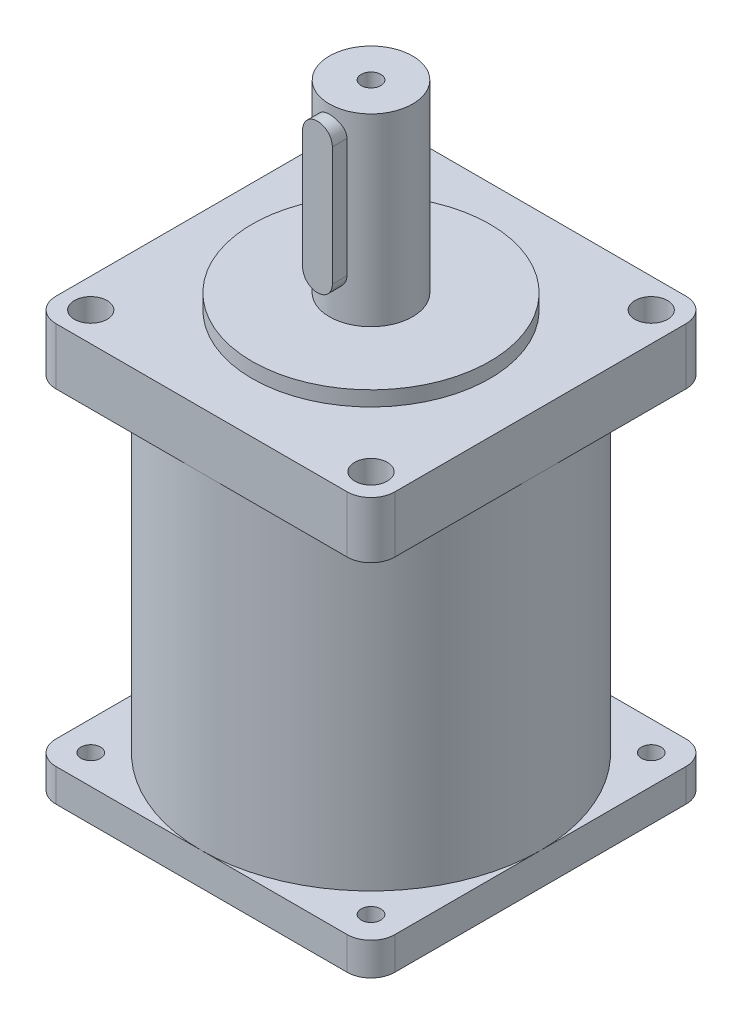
SolidWorks part; units mm, degrees
ref_plane "前视" through (0, 0, 0) normal (0, 0, 1) x (1, 0, 0)
ref_plane "上视" through (0, 0, 0) normal (0, 1, 0) x (1, 0, 0)
ref_plane "右视" through (0, 0, 0) normal (1, 0, 0) x (0, 0, -1)
sketch "草图1" plane through (0, 0, 0) normal (0, 1, 0) x (1, 0, 0)
  line L1 (-28.5, 28.5) -> (28.5, 28.5)
  line L2 (-28.5, 28.5) -> (-28.5, -28.5)
  line L3 (-28.5, -28.5) -> (28.5, -28.5)
  line L4 (28.5, 28.5) -> (28.5, -28.5)
  line L5 (-28.5, 28.5) -> (28.5, -28.5) construction
  line L6 (-28.5, -28.5) -> (28.5, 28.5) construction
  point P0 (0, 0)
extrude "凸台-拉伸1" add sketch "草图1" along normal blind 9.5
ref_plane "基准面1" through (0, 9.5, 0) normal (0, 1, 0) x (1, 0, 0)
sketch "草图2" plane through (0, 9.5, 0) normal (0, 1, 0) x (1, 0, 0)
  circle A0 centre (0, 0) radius 20
  dimension "D1" = 40
extrude "凸台-拉伸2" add sketch "草图2" along normal blind 2.5
sketch "草图3" plane through (0, 9.5, 0) normal (0, 1, 0) x (1, 0, 0)
  circle A0 centre (0, 0) radius 7
  dimension "D1" = 14
extrude "凸台-拉伸3" add sketch "草图3" along normal blind 33.5
sketch "草图4" plane through (0, 9.5, 0) normal (0, 1, 0) x (1, 0, 0)
  line L1 (-23.57, 23.57) -> (23.57, 23.57)
  line L2 (-23.57, 23.57) -> (-23.57, -23.57)
  line L3 (-23.57, -23.57) -> (23.57, -23.57)
  line L4 (23.57, 23.57) -> (23.57, -23.57)
  line L5 (-23.57, 23.57) -> (23.57, -23.57) construction
  line L6 (-23.57, -23.57) -> (23.57, 23.57) construction
  point P0 (0, 0)
sketch "草图5" plane through (0, 9.5, 0) normal (0, 1, 0) x (1, 0, 0)
  circle A0 centre (-23.57, 23.57) radius 2.75
  circle A1 centre (-23.57, -23.57) radius 2.75
  circle A2 centre (23.57, -23.57) radius 2.75
  circle A3 centre (23.57, 23.57) radius 2.75
  dimension "D1" = 5.5
  dimension "D2" = 5.5
  dimension "D3" = 5.5
  dimension "D4" = 5.5
extrude "切除-拉伸1" cut sketch "草图5" against normal blind 9.5
ref_plane "基准面2" through (0, 43, 0) normal (0, 1, 0) x (1, 0, 0)
hole_wizard "M4 螺纹孔1" positions "草图7" profile "草图6" tap size "M4" standard "ISO"
sketch "草图7" plane through (0, 43, 0) normal (0, 1, 0) x (1, 0, 0)
  point P0 (0, 0)
sketch "草图6" plane through (0, 43, 0) normal (1, 0, 0) x (0, 0, 1)
  line L0 (0, 0) -> (0, 12.4914)
  line L1 (0, 12.4914) -> (1.65, 11.5)
  line L2 (1.65, 11.5) -> (1.65, 0)
  line L5 (1.65, 0) -> (0, 0)
  line L10 (0, 12.4914) -> (-1.65, 11.5) construction
  line L11 (0, -6.35) -> (0, 107.95) construction
  dimension "螺纹孔钻头直径" = 3.3
  dimension "螺纹孔钻头深度" = 11.5
  dimension "导头角度" = 118
ref_plane "基准面3" through (0, 0, 4) normal (0, 0, 1) x (1, 0, 0)
sketch "草图8" plane through (0, 0, 4) normal (0, 0, 1) x (1, 0, 0)
  line L4 (-2.5, 39) -> (-2.5, 19)
  line L6 (2.5, 39) -> (2.5, 19)
  line L7 (-2.5, 39) -> (2.5, 19) construction
  line L8 (-2.5, 19) -> (2.5, 39) construction
  arc A0 (-2.5, 39) -> (2.5, 39) centre (0, 39) cw
  arc A1 (-2.5, 19) -> (2.5, 19) centre (0, 19) ccw
  point P5 (0, 29)
  dimension "D1" = 2.5
  dimension "D2" = 2.5
extrude "凸台-拉伸4" add sketch "草图8" along normal blind 5
sketch "草图9" plane through (0, 0, 0) normal (0, 1, 0) x (1, 0, 0)
  circle A0 centre (0, 0) radius 28.5
  dimension "D1" = 57
extrude "凸台-拉伸5" add sketch "草图9" against normal blind 55
ref_plane "基准面4" through (0, -55, 0) normal (0, -1, 0) x (-1, 0, 0)
sketch "草图10" plane through (0, -55, 0) normal (0, -1, 0) x (-1, 0, 0)
  line L1 (28.5, -28.5) -> (-28.5, -28.5)
  line L2 (28.5, -28.5) -> (28.5, 28.5)
  line L3 (28.5, 28.5) -> (-28.5, 28.5)
  line L4 (-28.5, -28.5) -> (-28.5, 28.5)
  line L5 (28.5, -28.5) -> (-28.5, 28.5) construction
  line L6 (28.5, 28.5) -> (-28.5, -28.5) construction
  point P0 (0, 0)
extrude "凸台-拉伸6" add sketch "草图10" along normal blind 5.5
hole_wizard "M4 螺纹孔2" positions "草图12" profile "草图11" tap size "M4" standard "ISO"
sketch "草图12" plane through (0, -55, 0) normal (0, -1, 0) x (-1, 0, 0)
  point P0 (23.57, -23.57)
  point P3 (23.57, 23.57)
  point P6 (-23.57, 23.57)
  point P9 (-23.57, -23.57)
sketch "草图11" plane through (-23.57, -55, 23.57) normal (1, 0, 0) x (0, 0, 1)
  line L0 (0, 0) -> (0, 9.9914)
  line L1 (0, 9.9914) -> (1.65, 9)
  line L2 (1.65, 9) -> (1.65, 0)
  line L5 (1.65, 0) -> (0, 0)
  line L10 (0, 9.9914) -> (-1.65, 9) construction
  line L11 (0, -6.35) -> (0, 107.95) construction
  dimension "螺纹孔钻头直径" = 3.3
  dimension "螺纹孔钻头深度" = 9
  dimension "导头角度" = 118
fillet "圆角1" radius 4 8 edges at (-28.5, -57.75, 28.5) (28.5, -57.75, 28.5) (28.5, -57.75, -28.5) (-28.5, -57.75, -28.5) (-28.5, 4.75, -28.5) (28.5, 4.75, -28.5) (28.5, 4.75, 28.5) (-28.5, 4.75, 28.5)
ref_plane "基准面5" through (0, -60.5, 0) normal (0, -1, 0) x (-1, 0, 0)
sketch "草图13" plane through (0, -60.5, 0) normal (0, -1, 0) x (-1, 0, 0)
  circle A0 centre (0, 0) radius 19.05
  dimension "D1" = 38.1
extrude "切除-拉伸2" cut sketch "草图13" against normal blind 2.5
sketch "草图14" plane through (0, -60.5, 0) normal (0, -1, 0) x (-1, 0, 0)
  circle A0 centre (0, 0) radius 4
  dimension "D1" = 8
extrude "切除-拉伸3" cut sketch "草图14" against normal blind 7
